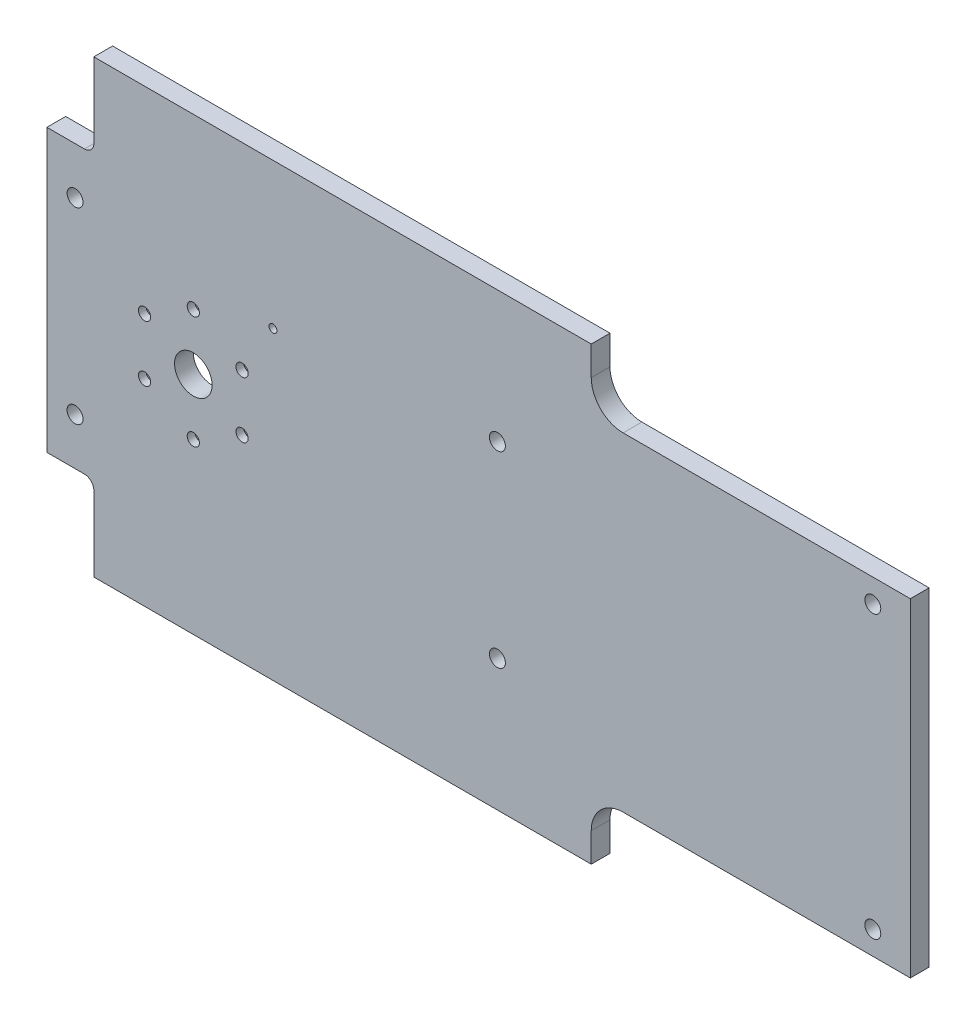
SolidWorks part; units mm, degrees
ref_plane "Plan1" through (0, 0, 0) normal (0, 0, 1) x (1, 0, 0)
ref_plane "Plan2" through (0, 0, 0) normal (0, 1, 0) x (1, 0, 0)
ref_plane "Plan3" through (0, 0, 0) normal (1, 0, 0) x (0, 0, -1)
sketch "Esquisse1" plane through (0, 0, 0) normal (0, 0, 1) x (1, 0, 0)
  line L0 (-78, 0) -> (390, 0) construction
  line L1 (-53, 120) -> (212, 120)
  line L2 (-78, 75) -> (-78, -75)
  line L3 (-53, -120) -> (212, -120)
  line L4 (382, 87.5) -> (382, -87.5)
  line L5 (-53, -120) -> (-53, -80)
  line L6 (-78, -75) -> (-58, -75)
  line L7 (382, 87.5) -> (229, 87.5)
  line L8 (212, 104.5) -> (212, 120)
  line L10 (382, -87.5) -> (229, -87.5)
  line L11 (212, -104.5) -> (212, -120)
  line L12 (-78, 75) -> (-58, 75)
  line L13 (-53, 120) -> (-53, 80)
  circle A0 centre (0, 0) radius 9.75
  circle A1 centre (162, 50) radius 4
  circle A2 centre (162, -50) radius 4
  circle A3 centre (42.43, 42.43) radius 1.9
  arc A4 (212, 104.5) -> (229, 87.5) centre (229, 104.5) ccw
  circle A5 centre (362, 75) radius 4
  circle A6 centre (-63, 50) radius 4
  circle A7 centre (-63, -50) radius 4
  circle A8 centre (362, -75) radius 4
  arc A9 (-53, 80) -> (-58, 75) centre (-58, 80) cw
  arc A10 (212, -104.5) -> (229, -87.5) centre (229, -104.5) cw
  arc A11 (-53, -80) -> (-58, -75) centre (-58, -80) ccw
  point P40 (212, -87.5)
  dimension "D5" = 19.5
  dimension "D6" = 175
  dimension "D8" = 25
  dimension "D10" = 45
  dimension "D32" = 17
  dimension "D30" = 8
  dimension "D13" = 8
  dimension "D4" = 3.8
  dimension "D15" = 5
  dimension "D1" = 460
  dimension "D2" = 240
  dimension "D3" = 78
  dimension "D7" = 150
  dimension "D9" = 100
  dimension "D11" = 42.43
  dimension "D12" = 42.43
  dimension "D14" = 20
  dimension "D16" = 225
  dimension "D20" = 15
  dimension "D29" = 170
extrude "Base-Extrusion" add sketch "Esquisse1" along normal blind 10
sketch "Esquisse2" plane through (0, 0, 10) normal (0, 0, 1) x (1, 0, 0)
  line L0 (0, 0) -> (-55.4527, 32.0156) construction
  line L1 (0, 0) -> (-90, 0) construction
  circle A0 centre (-25.9808, 15) radius 3.25
  dimension "D1" = 30
  dimension "D2" = 6.5
  dimension "D3" = 30
extrude "Enlèv. mat.-Extru.1" cut sketch "Esquisse2" against normal through all
sketch "Esquisse3" plane through (0, 0, 0) normal (0, 0, -1) x (-1, 0, 0)
  circle A0 centre (25.9808, 15) radius 6.5
  circle A1 centre (25.9808, 15) radius 3.25 construction
  dimension "D1" = 13
extrude "Enlèv. mat.-Extru.2" cut sketch "Esquisse3" against normal blind 6
pattern_circular "Répétition circulaire1" count 6 every 60
sketch "Esquisse4" plane through (0, 0, 10) normal (0, 0, 1) x (1, 0, 0)
  circle A0 centre (362, 75) radius 4.25
  circle A1 centre (362, -75) radius 4.25
  circle A2 centre (162, -50) radius 4.25
  circle A3 centre (162, 50) radius 4.25
  circle A4 centre (-63, 50) radius 4.25
  circle A5 centre (-63, -50) radius 4.25
  circle A6 centre (-63, 50) radius 4 construction
  circle A7 centre (-63, -50) radius 4 construction
  circle A8 centre (162, 50) radius 4 construction
  circle A9 centre (162, -50) radius 4 construction
  circle A10 centre (362, -75) radius 4 construction
  circle A11 centre (362, 75) radius 4 construction
  circle A12 centre (42.43, 42.43) radius 2.1
  circle A13 centre (42.43, 42.43) radius 1.9 construction
  circle A14 centre (0, 0) radius 10
  circle A15 centre (0, 0) radius 9.75 construction
  dimension "D1" = 8.5
  dimension "D2" = 4.2
  dimension "D3" = 20
extrude "Enlèv. mat.-Extru.3" cut sketch "Esquisse4" against normal through all
